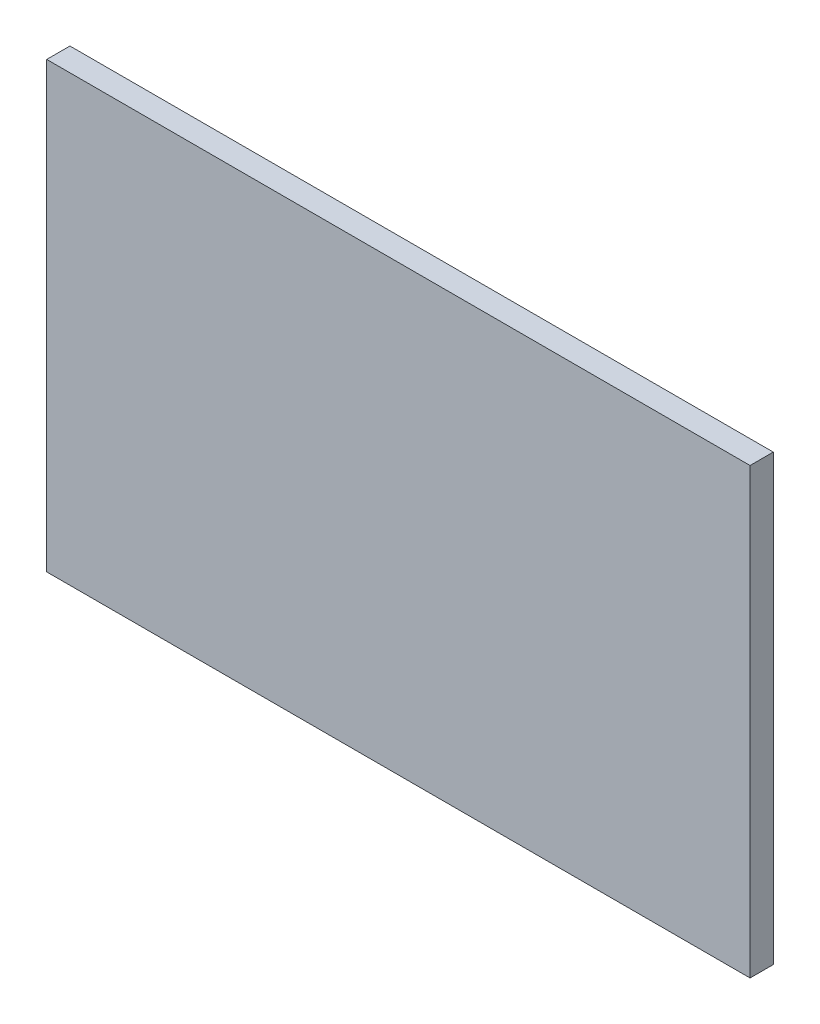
SolidWorks part; units mm, degrees
ref_plane "Plan de face" through (0, 0, 0) normal (0, 0, 1) x (1, 0, 0)
ref_plane "Plan de dessus" through (0, 0, 0) normal (0, 1, 0) x (1, 0, 0)
ref_plane "Plan de droite" through (0, 0, 0) normal (1, 0, 0) x (0, 0, -1)
sketch "Esquisse1" plane through (0, 0, 0) normal (0, 0, 1) x (1, 0, 0)
  line L1 (-154.5, 97.5) -> (154.5, 97.5)
  line L2 (-154.5, 97.5) -> (-154.5, -97.5)
  line L3 (-154.5, -97.5) -> (154.5, -97.5)
  line L4 (154.5, 97.5) -> (154.5, -97.5)
  line L5 (-154.5, 97.5) -> (154.5, -97.5) construction
  line L6 (-154.5, -97.5) -> (154.5, 97.5) construction
  point P0 (0, 0)
  dimension "D1" = 309
  dimension "D2" = 195
extrude "Boss.-Extru.1" add sketch "Esquisse1" along normal mid plane 10.2
